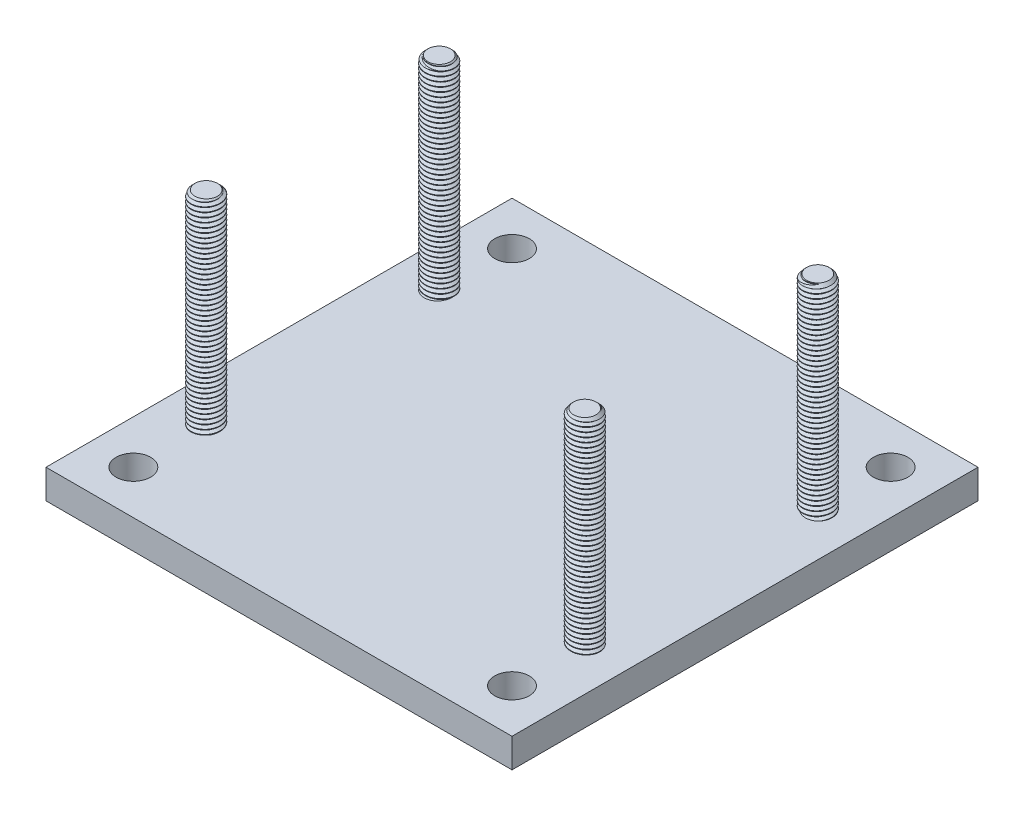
SolidWorks part; units mm, degrees
other "<3313N36_High-Strength Steel Threaded Rod>-<Cut-Sweep3>"
ref_plane "Front Plane" through (0, 0, 0) normal (0, 0, 1) x (1, 0, 0)
ref_plane "Top Plane" through (0, 0, 0) normal (0, 1, 0) x (1, 0, 0)
ref_plane "Right Plane" through (0, 0, 0) normal (1, 0, 0) x (0, 0, -1)
sketch "Sketch1" plane through (0, 0, 0) normal (0, 1, 0) x (1, 0, 0)
  line L1 (-101.6, 101.6) -> (101.6, 101.6)
  line L2 (-101.6, 101.6) -> (-101.6, -101.6)
  line L3 (-101.6, -101.6) -> (101.6, -101.6)
  line L4 (101.6, 101.6) -> (101.6, -101.6)
  line L5 (-101.6, 101.6) -> (101.6, -101.6) construction
  line L6 (-101.6, -101.6) -> (101.6, 101.6) construction
  point P0 (0, 0)
  dimension "D1" = 203.2
extrude "Boss-Extrude1" add sketch "Sketch1" along normal blind 12.7
hole_wizard "1/2-13 Tapped Hole1" positions "Sketch2" profile "Sketch3" tap size "1/2-13" standard "ANSI Inch"
sketch "Sketch2" plane through (0, 12.7, 0) normal (0, 1, 0) x (1, 0, 0)
  point P0 (-82.55, -50.8)
  point P3 (82.55, -50.8)
  point P6 (-82.55, 50.8)
  point P9 (82.55, 50.8)
sketch "Sketch3" plane through (-82.55, 12.7, 50.8) normal (1, 0, 0) x (0, 0, 1)
  line L0 (0, 0) -> (0, 12.7)
  line L1 (0, 12.7) -> (5.3581, 12.7)
  line L2 (5.3581, 12.7) -> (5.3581, 0)
  line L5 (5.3581, 0) -> (0, 0)
  line L11 (0, -6.35) -> (0, 107.95) construction
  dimension "Thread Major Dia." = 10.7163
  dimension "Thru Tap Drill Depth" = 12.7
hole_wizard "9/16 Clearance Hole1" positions "Sketch4" profile "Sketch5" hole size "9/16" standard "ANSI Inch"
sketch "Sketch4" plane through (0, 12.7, 0) normal (0, 1, 0) x (1, 0, 0)
  line L0 (-101.6, 0) -> (-95.2664, 0) construction
  line L1 (-101.6, 101.6) -> (-101.6, -101.6) construction
  line L4 (-82.55, -50.8) -> (-82.55, -82.55) construction
  line L6 (-101.6, -101.6) -> (101.6, -101.6) construction
  line L7 (0, -101.6) -> (0, -96.8124) construction
  point P0 (-82.55, -82.55)
  point P2 (-82.55, 82.55)
  point P25 (82.55, -82.55)
  point P26 (82.55, 82.55)
  dimension "D1" = 19.05
sketch "Sketch5" plane through (-82.55, 12.7, 82.55) normal (1, 0, 0) x (0, 0, 1)
  line L0 (0, 0) -> (0, 12.7)
  line L1 (0, 12.7) -> (7.54, 12.7)
  line L2 (7.54, 12.7) -> (7.54, 0)
  line L5 (7.54, 0) -> (0, 0)
  line L11 (0, -6.35) -> (0, 107.95) construction
  dimension "Thru Hole Dia." = 15.08
  dimension "Thru Hole Depth" = 12.7
inserted part "3313N36_High-Strength Steel Threaded Rod"
move or copy body "Body-Move/Copy4" placed by mates yes
mirror "Mirror3" about plane through (0, 0, 0) normal (0, 0, 1)
mirror "Mirror4" about plane through (0, 0, 0) normal (1, 0, 0)
delete or keep bodies "Body-Delete/Keep 1" [suppressed] type keep bodies bodies 103
